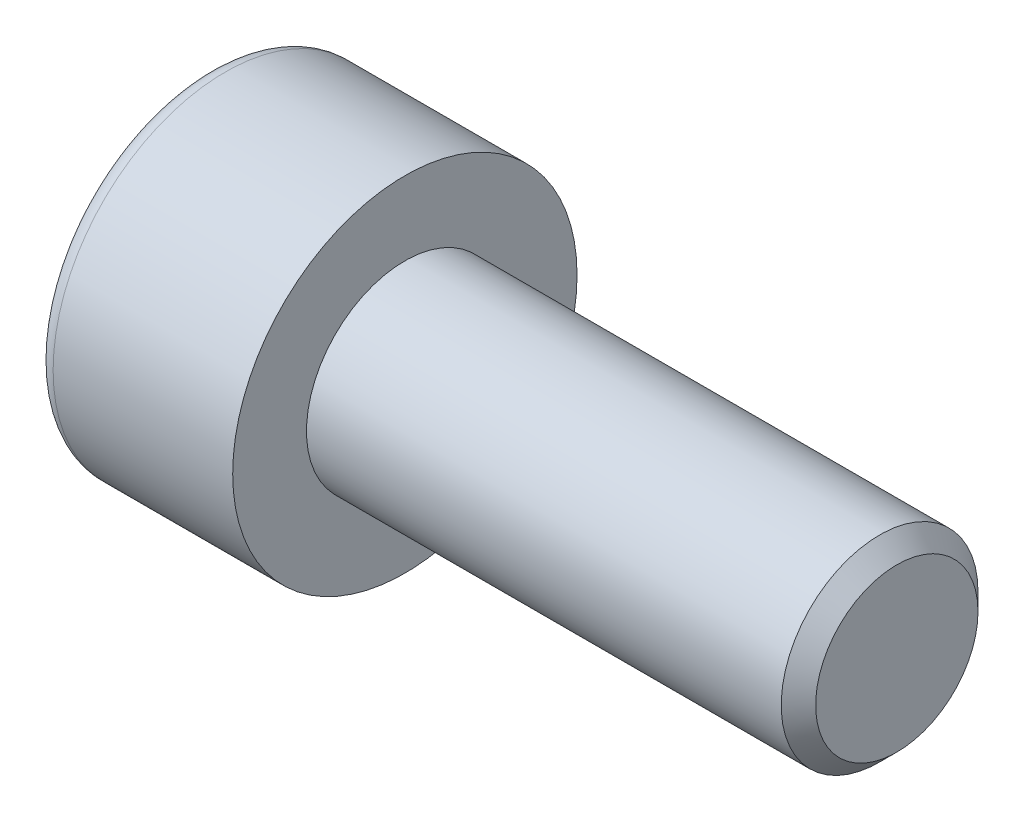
SolidWorks part; units mm, degrees
ref_plane "Plan1" through (0, 0, 0) normal (0, 0, 1) x (1, 0, 0)
ref_plane "Plan2" through (0, 0, 0) normal (0, 1, 0) x (1, 0, 0)
ref_plane "Plan3" through (0, 0, 0) normal (1, 0, 0) x (0, 0, -1)
sketch "Esquisse1" plane through (0, 0, 0) normal (0, 0, 1) x (1, 0, 0)
  line L0 (12.5013, 0) -> (-4.9882, 0) construction
  line L1 (0, 2) -> (0, 3.5)
  line L2 (0, 2) -> (10, 2)
  line L3 (10, 2) -> (10, 0)
  line L4 (0, 3.5) -> (-4, 3.5)
  line L5 (-4, 3.5) -> (-4, 0)
  line L6 (10, 0) -> (-4, 0)
  dimension "Ø tige" = 4
  dimension "Ø tete" = 7
  dimension "longueur tige" = 10
  dimension "hauteur tete" = 4
revolve "Base-Révolution" add sketch "Esquisse1" angle 360 about L0
chamfer "Chanfrein tige" distance 0.35 angle 45 1 edges at (10, 0, -2)
fillet "Congé tete" radius 0.35 1 edges at (-4, 0, -3.5)
sketch "Esquisse2" plane through (-4, 0, 0) normal (-1, 0, 0) x (0, 0, 1)
  line L1 (1.7321, 0) -> (0.866, 1.5)
  line L2 (0.866, 1.5) -> (-0.866, 1.5)
  line L3 (-0.866, 1.5) -> (-1.7321, 0)
  line L4 (-1.7321, 0) -> (-0.866, -1.5)
  line L5 (-0.866, -1.5) -> (0.866, -1.5)
  line L6 (0.866, -1.5) -> (1.7321, 0)
  circle A0 centre (0, 0) radius 1.5 construction
  dimension "largeur creux" = 3
extrude "Enlèv. mat.-Extru.1" cut sketch "Esquisse2" against normal blind 2.4
